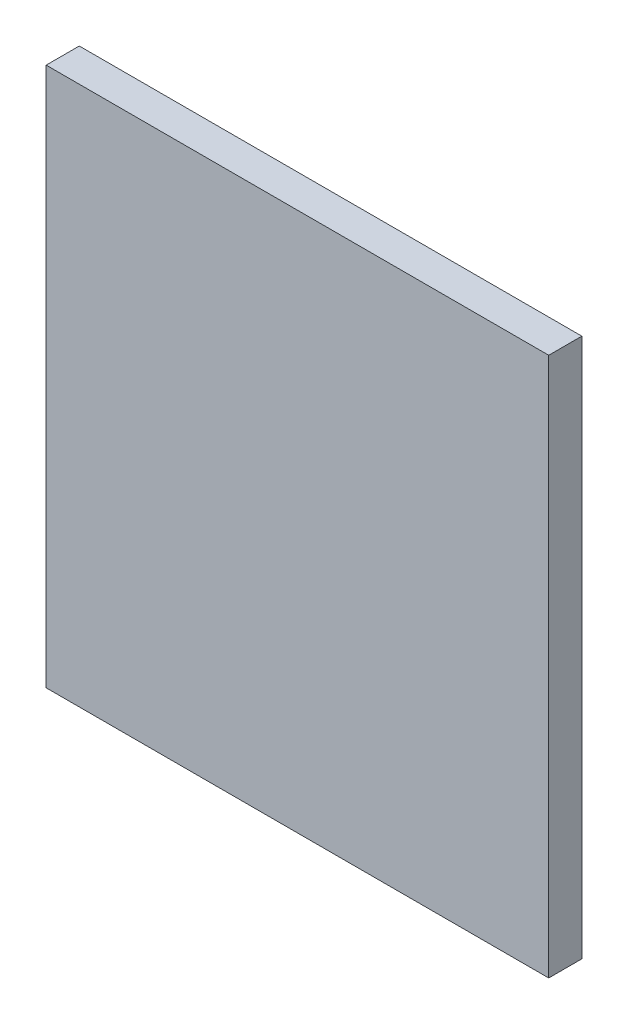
SolidWorks part; units mm, degrees
ref_plane "Plan de face" through (0, 0, 0) normal (0, 0, 1) x (1, 0, 0)
ref_plane "Plan de dessus" through (0, 0, 0) normal (0, 1, 0) x (1, 0, 0)
ref_plane "Plan de droite" through (0, 0, 0) normal (1, 0, 0) x (0, 0, -1)
sketch "Esquisse1" plane through (0, 0, 0) normal (0, 0, 1) x (1, 0, 0)
  line L1 (0, 480) -> (410, 480)
  line L2 (0, 480) -> (0, 40)
  line L3 (0, 40) -> (410, 40)
  line L4 (410, 480) -> (410, 40)
extrude "Boss.-Extru.1" add sketch "Esquisse1" against normal blind 27
